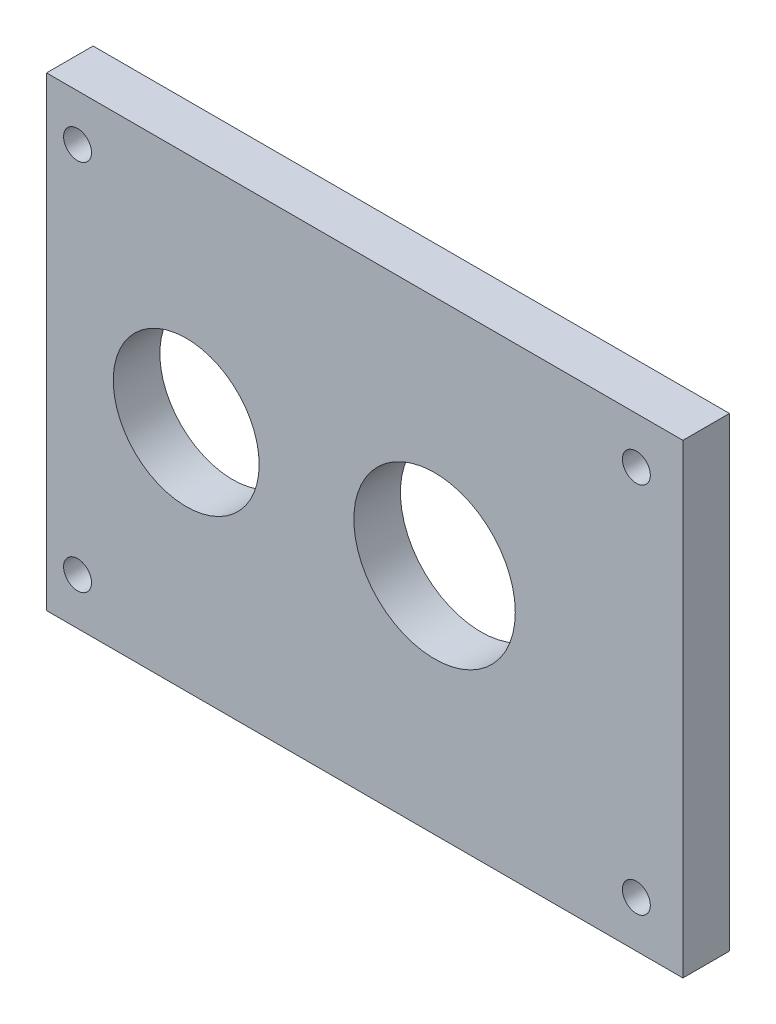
SolidWorks part; units mm, degrees
ref_plane "Front Plane" through (0, 0, 0) normal (0, 0, 1) x (1, 0, 0)
ref_plane "Top Plane" through (0, 0, 0) normal (0, 1, 0) x (1, 0, 0)
ref_plane "Right Plane" through (0, 0, 0) normal (1, 0, 0) x (0, 0, -1)
sketch "Skizze1" plane through (0, 0, 0) normal (0, 0, 1) x (1, 0, 0)
  line L1 (-45, -75) -> (160, -75)
  line L2 (-45, -75) -> (-45, 75)
  line L3 (-45, 75) -> (160, 75)
  line L4 (160, -75) -> (160, 75)
extrude "Aufsatz-Linear austragen1" add sketch "Skizze1" along normal blind 15
sketch "Skizze2" plane through (0, 0, 0) normal (0, 0, 1) x (1, 0, 0)
  circle A0 centre (0, 0) radius 23.5
  circle A1 centre (80, 0) radius 26
  circle A2 centre (-35, -60) radius 4.5
  circle A3 centre (145, -60) radius 4.5
  circle A4 centre (-35, 60) radius 4.5
  circle A5 centre (145, 60) radius 4.5
  dimension "D1" = 47
  dimension "D2" = 52
extrude "Schnitt-Linear austragen1" cut sketch "Skizze2" against normal through all and the other way through all
